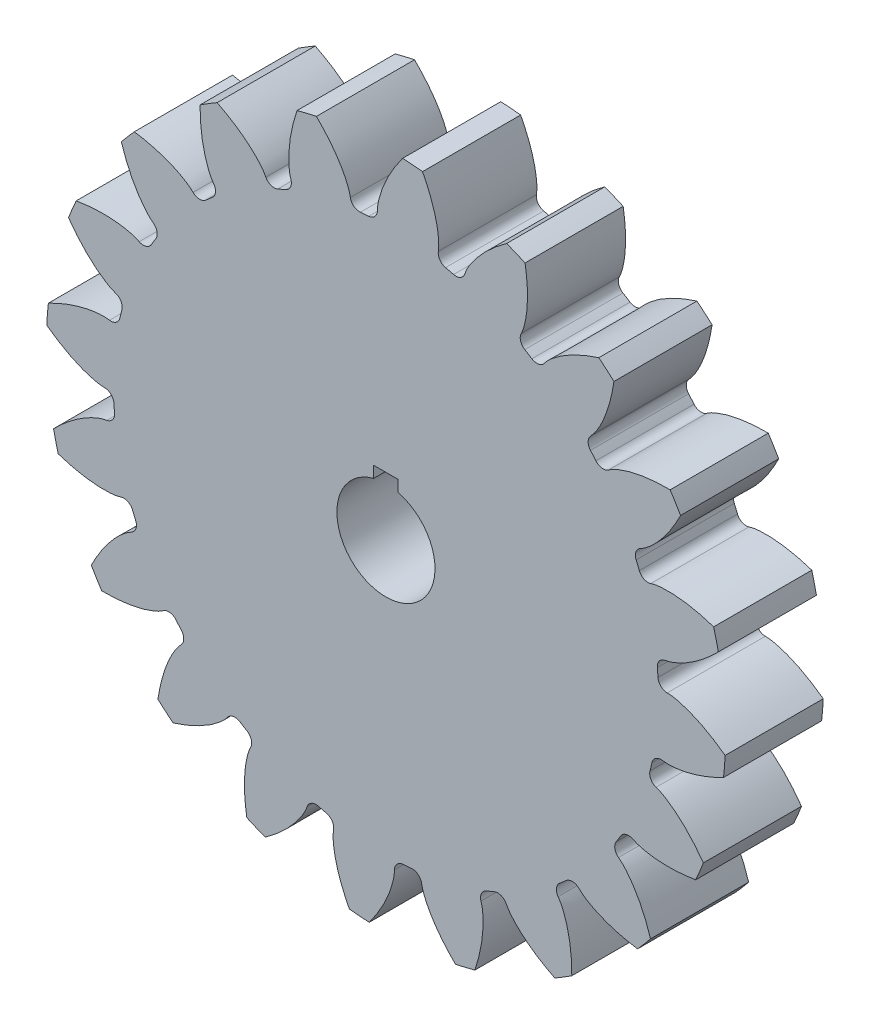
SolidWorks part; units mm, degrees
ref_plane "Front" through (0, 0, 0) normal (0, 0, 1) x (1, 0, 0)
ref_plane "Top" through (0, 0, 0) normal (0, 1, 0) x (1, 0, 0)
ref_plane "Right" through (0, 0, 0) normal (1, 0, 0) x (0, 0, -1)
sketch "Sketch3" plane through (0, 0, 0) normal (0, 0, 1) x (1, 0, 0)
  line L0 (-5.0679, 22.86) -> (0, 0)
  line L1 (0, 0) -> (5.0679, 22.86)
  line L2 (5.0679, 22.86) -> (-5.0679, 22.86) construction
  line L3 (-127, 22.86) -> (127, 22.86)
  line L4 (-254, 0) -> (254, 0)
  line L5 (0, 0) -> (0, 22.86) construction
  dimension "pressure angle" = 25
  dimension "teeth" = 508
  dimension "diametral pitch" = 254
  dimension "% of profile shift" = 22.86
sketch "Sketch1" plane through (0, 0, 0) normal (0, 0, 1) x (1, 0, 0)
  line L0 (-0.6899, 23.0099) -> (0, 0) construction
  line L1 (0, 0) -> (2.3819, 22.8967) construction
  line L2 (2.3819, 22.8967) -> (-0.6778, 23.215) construction
  line L3 (-0.5688, 23.8214) -> (5.4114, 22.3752) construction
  line L4 (5.4114, 22.3752) -> (0, 0) construction
  line L5 (0, 0) -> (8.3443, 21.4547) construction
  line L6 (8.3443, 21.4547) -> (-0.2569, 24.7999) construction
  line L7 (0.3567, 26.1001) -> (11.1284, 20.1516) construction
  line L8 (11.1284, 20.1516) -> (0, 0) construction
  line L9 (1.3602, 27.6526) -> (13.7141, 18.4893) construction
  line L10 (13.7141, 18.4893) -> (0, 0) construction
  line L11 (-25.4, 0) -> (-27.686, 0) construction
  line L12 (9.7288, 20.8634) -> (0, 0) construction
  line L13 (3.9739, 25.0872) -> (0, 25.4) construction
  line L14 (0, 25.4) -> (9.7288, 20.8634) construction
  line L15 (0, 25.4) -> (0, 0) construction
  line L16 (0, 25.4) -> (1.0453, 25.4) construction
  line L17 (3.9739, 25.0872) -> (0, 0) construction
  line L18 (-0.6899, 23.0099) -> (-0.6661, 22.215) construction
  line L22 (0.8047, 26.8499) -> (12.449, 19.3637) construction
  line L23 (2.1725, 27.6006) -> (0, 0) construction
  line L24 (0, 0) -> (12.449, 19.3637) construction
  circle A0 centre (0, 0) radius 25.4 construction
  circle A1 centre (0, 0) radius 22.225 construction
  circle A2 centre (0, 0) radius 23.0202 construction
  circle A5 centre (0, 0) radius 27.686 construction
  arc A7 (1.3602, 27.6526) -> (2.9829, 27.5248) centre (0, 0) cw
  arc A8 (4.1335, 21.8372) -> (-0.6661, 22.215) centre (0, 0) ccw
  spline S0 degree 3 poles (-0.6661, 22.215) (-0.6822, 22.48) (-0.7024, 22.8134) (-0.6727, 23.3521) (-0.5499, 23.9586) (-0.2327, 24.9374) (0.2522, 25.9431) (0.8126, 26.8857) (1.1711, 27.3876) (1.3602, 27.6526) knots 0 0 0 0 0.134075 0.168713 0.272605 0.445753 0.688161 0.835418 1 1 1 1
  spline S1 degree 3 poles (4.1335, 21.8372) (4.1909, 22.0964) (4.263, 22.4225) (4.318, 22.9592) (4.2916, 23.5775) (4.1314, 24.5939) (3.8099, 25.6631) (3.4037, 26.6817) (3.1283, 27.2336) (2.9829, 27.5248) knots 0 0 0 0 0.134075 0.168713 0.272605 0.445753 0.688161 0.835418 1 1 1 1
  point P12 (1.987, 25.2436)
  point P45 (3.9739, 25.0872)
  point P50 (11.1787, 25.3288)
sketch "Sketch2" plane through (0, 0, 0) normal (0, 0, 1) x (1, 0, 0)
  circle A3 centre (0, 0) radius 22.225 construction
  circle A4 centre (0, 0) radius 22.225
extrude "Extrude1" add sketch "Sketch2" along normal blind 8
extrude "Extrude2" add sketch "Sketch1" along normal up to surface (8 mm away)
fillet "Fillet1" radius 0.762 2 edges at (4.1335, 21.8372, 4) (-0.6661, 22.215, 4)
pattern_circular "CirPattern1" count 20 over 360 about axis through (0, 0, 8) along (0, 0, -1) of "Extrude2", "Fillet1"
scale "Scale1" scale about centroid uniform scaling yes scale factor 0.25
sketch "Sketch4" plane through (0, 0, 5) normal (0, 0, 1) x (1, 0, 0)
  circle A0 centre (0, 0) radius 1
  dimension "D1" = 2
extrude "Extrude3" cut sketch "Sketch4" against normal through all
sketch "Sketch5" plane through (0, 0, 5) normal (0, 0, 1) x (1, 0, 0)
  line L0 (0, 0) -> (0, 1.2) construction
  line L1 (-0.25, 0) -> (-0.25, 1.2)
  line L2 (-0.25, 1.2) -> (0.25, 1.2)
  line L3 (0.25, 0) -> (0.25, 1.2)
  line L4 (-0.25, 0) -> (0.25, 0)
  dimension "D1" = 1.2
  dimension "D2" = 0.5
extrude "Extrude4" cut sketch "Sketch5" against normal through all
equation "\"Pd\"= 16 ' \"diametral pitch\""
equation "\"N\"= 18 ' Number of \"teeth\""
equation "\"a\"=1/\"Pd\" ' Addendum"
equation "\"d\"= \"N\"/\"Pd\" ' \"Pitch diameter\""
equation "\"phi\"= 20*pi/180 "
equation "\"b\"= 1.25 / \"Pd\" ' \"Dedendum\""
equation "\"br\"=\"d\"/2-\"b\" 'Base Circle Radius"
equation "\"working depth\"= 2 / \"Pd\""
equation "\"Whole depth\"= 2.25 / \"Pd\""
equation "\"Circular tooth thickness\"= 1.571 /\"Pd\""
equation "\"Fillet radius\"= .3 / \"Pd\""
equation "\"minimum basic clearance\"= .25 /\"Pd\""
equation "\"minimum width of top land\"= .25 / \"Pd\""
equation "\"Involute Length 1@Sketch1\" = \"Involute Angle 5@Sketch1\"*\"D1@Sketch1\""
equation "\"Involute Length 2@Sketch1\"=\"Involute Angle 2@Sketch1\"*\"D1@Sketch1\""
equation "\"Involute Length 3@Sketch1\"=\"Involute Angle 3@Sketch1\"*\"D1@Sketch1\""
equation "\"Involute Length 4@Sketch1\"=\"Involute Angle 4@Sketch1\"*\"D1@Sketch1\""
equation "\"Involute Length 6@Sketch1\"=\"Involute Angle 6@Sketch1\"*\"D1@Sketch1\""
equation "\"pressure angle@Sketch1\" = \"phi\""
equation "\"Pitch diameter@Sketch1\" = \"d\""
equation "\"Dedendum@Sketch1\" = \"b\""
equation "\"Fillet Radius@Sketch1\"=\"Fillet radius\""
equation "\"measured circular tooth thickness\"= \"D17@Sketch1\"*\"D20@Sketch1\""
equation "\"Tooth Thickness Angle@Sketch1\"=\"Circular tooth thickness\"/(\"d\"/2)"
equation "\"Involute Crux Angle@Sketch1\"=\"D15@Sketch1\"/\"D1@Sketch1\""
equation "\"Involute Length 5@Sketch1\"=\"Involute Angle 5@Sketch1\"*\"D1@Sketch1\""
